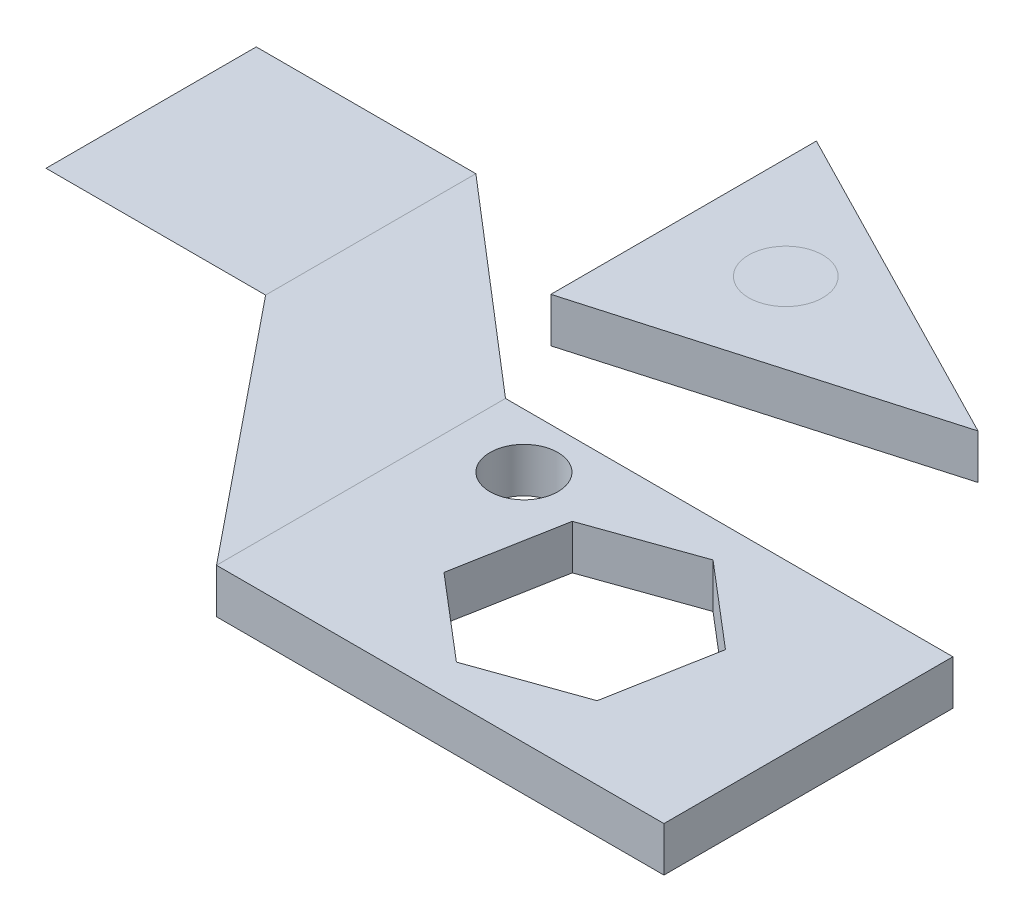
SolidWorks part; units mm, degrees
ref_plane "Front Plane" through (0, 0, 0) normal (0, 0, 1) x (1, 0, 0)
ref_plane "Top Plane" through (0, 0, 0) normal (0, 1, 0) x (1, 0, 0)
ref_plane "Right Plane" through (0, 0, 0) normal (1, 0, 0) x (0, 0, -1)
sketch "Sketch1" plane through (0, 0, 0) normal (0, 1, 0) x (1, 0, 0)
  line L1 (-205.7504, 38.1055) -> (-80.7821, 38.1055)
  line L2 (-205.7504, 38.1055) -> (-205.7504, -81.5293)
  line L3 (-205.7504, -81.5293) -> (-80.7821, -81.5293)
  line L4 (-80.7821, 38.1055) -> (-80.7821, -81.5293)
sketch "Sketch2" plane through (0, 0, 0) normal (0, 1, 0) x (1, 0, 0)
  line L0 (0, 0) -> (0, 151.0888)
  line L1 (0, 151.0888) -> (188.8508, 54.2005)
  line L2 (188.8508, 54.2005) -> (0, 0)
  line L4 (38.4002, -64.2241) -> (292.9816, -64.2241)
  line L5 (38.4002, -64.2241) -> (38.4002, -228.6412)
  line L6 (38.4002, -228.6412) -> (292.9816, -228.6412)
  line L7 (292.9816, -64.2241) -> (292.9816, -228.6412)
  line L8 (213.4249, -187.095) -> (224.7725, -125.425)
  line L9 (224.7725, -125.425) -> (177.0385, -84.7627)
  line L10 (177.0385, -84.7627) -> (117.9569, -105.7704)
  line L11 (117.9569, -105.7704) -> (106.6093, -167.4404)
  line L12 (106.6093, -167.4404) -> (154.3433, -208.1027)
  line L13 (154.3433, -208.1027) -> (213.4249, -187.095)
  circle A0 centre (58.0016, 75.6758) radius 21.0766
  circle A1 centre (165.6909, -146.4327) radius 54.3044 construction
  circle A2 centre (79.9465, -95.2665) radius 19.3435
extrude "Boss-Extrude1" add sketch "Sketch2" against normal blind 25.4
other "DeleteFace1"
surface "Surface-Plane1" sketch "Sketch1"
surface "Surface-Plane2"
surface "Surface-Plane3"
surface "Surface-Plane4"
